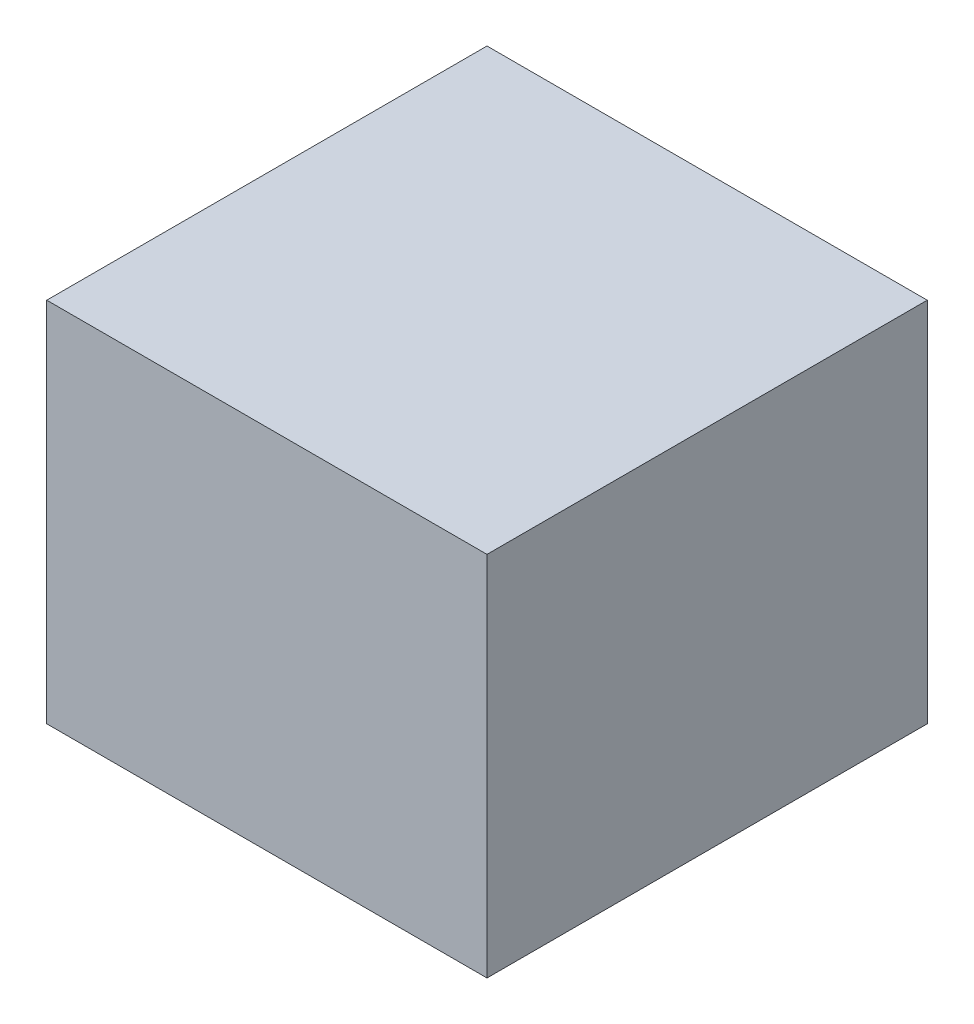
SolidWorks part; units mm, degrees
ref_plane "Front" through (0, 0, 0) normal (0, 0, 1) x (1, 0, 0)
ref_plane "Top" through (0, 0, 0) normal (0, 1, 0) x (1, 0, 0)
ref_plane "Right" through (0, 0, 0) normal (1, 0, 0) x (0, 0, -1)
sketch "Sketch1" plane through (0, 0, 0) normal (0, 1, 0) x (-1, 0, 0)
  line L0 (30, -30) -> (-30, 30) construction
  line L1 (-30, 30) -> (30, 30)
  line L2 (-30, 30) -> (-30, -30)
  line L3 (-30, -30) -> (30, -30)
  line L4 (30, 30) -> (30, -30)
  dimension "D1" = 60
  dimension "D2" = 60
extrude "Extrude1" add sketch "Sketch1" along normal blind 50 separate body
